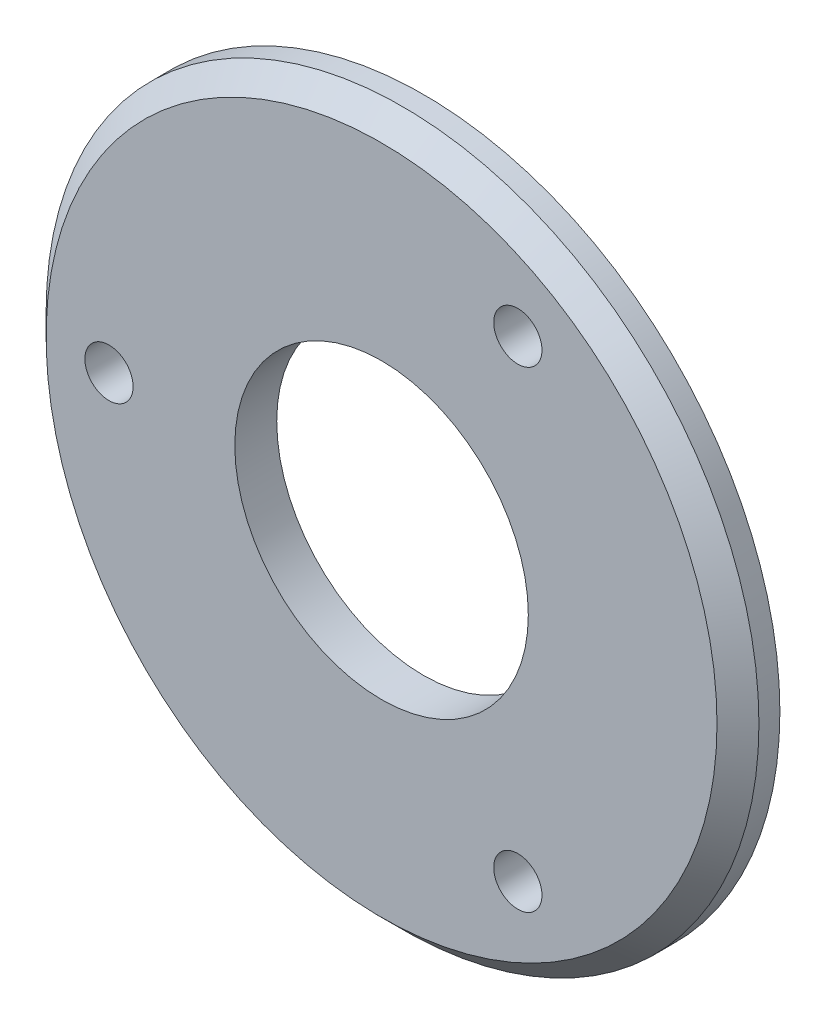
SolidWorks part; units mm, degrees
ref_plane "Plan de face" through (0, 0, 0) normal (0, 0, 1) x (1, 0, 0)
ref_plane "Plan de dessus" through (0, 0, 0) normal (0, 1, 0) x (1, 0, 0)
ref_plane "Plan de droite" through (0, 0, 0) normal (1, 0, 0) x (0, 0, -1)
sketch "Esquisse1" plane through (0, 0, 0) normal (0, 0, 1) x (1, 0, 0)
  circle A0 centre (0, 0) radius 35
  circle A1 centre (0, 0) radius 85
  dimension "D1" = 170
  dimension "D2" = 70
extrude "Boss.-Extru.1" add sketch "Esquisse1" along normal blind 10
sketch "Esquisse2" plane through (0, 0, 10) normal (0, 0, 1) x (1, 0, 0)
  line L0 (0, 0) -> (108.0377, 0) construction
  line L1 (0, 0) -> (55.4984, 96.1261) construction
  circle A0 centre (32.5, 56.2917) radius 5.75
  dimension "D3" = 11.5
  dimension "D1" = 60
  dimension "D2" = 65
extrude "Enlèv. mat.-Extru.2" cut sketch "Esquisse2" against normal up to surface (10 mm away)
pattern_circular "Répétition circulaire1" count 3 over 360 about axis through (0, 0, 0) along (0, 0, 1) of "Enlèv. mat.-Extru.2"
chamfer "Chanfrein1" distance 5 angle 45 1 edges at (85, 0, 10)
